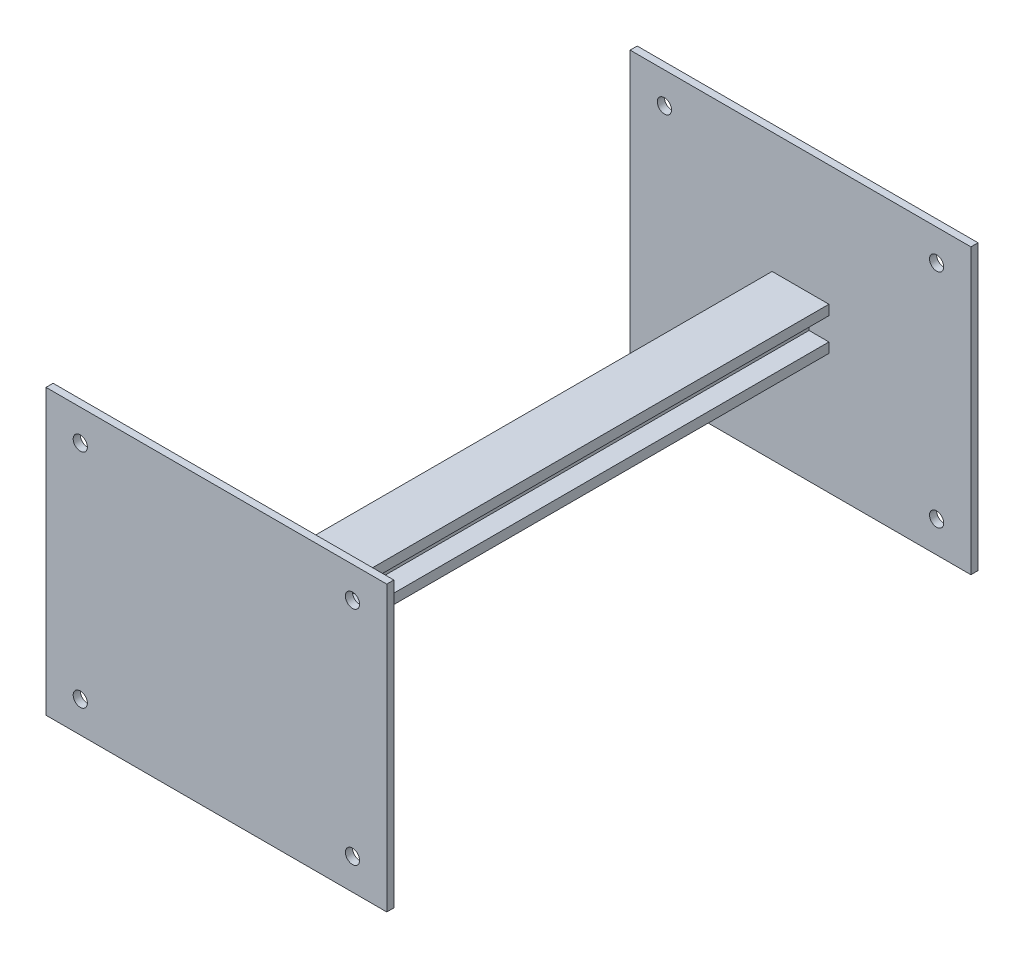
SolidWorks part; units mm, degrees
ref_plane "Front Plane" through (0, 0, 0) normal (0, 0, 1) x (1, 0, 0)
ref_plane "Top Plane" through (0, 0, 0) normal (0, 1, 0) x (1, 0, 0)
ref_plane "Right Plane" through (0, 0, 0) normal (1, 0, 0) x (0, 0, -1)
sketch "Sketch1" plane through (0, 0, 0) normal (0, 0, 1) x (1, 0, 0)
  line L0 (-7.62, 10.16) -> (-25.4, 10.16)
  line L1 (25.4, 10.16) -> (25.4, 19.05)
  line L2 (7.62, 10.16) -> (25.4, 10.16)
  line L3 (-25.4, -19.05) -> (25.4, -19.05)
  line L4 (-25.4, 10.16) -> (-25.4, 19.05)
  line L5 (-25.4, -10.16) -> (-25.4, -19.05)
  line L6 (-7.62, 0) -> (7.62, 0) construction
  line L7 (7.62, 10.16) -> (7.62, -10.16)
  line L8 (7.62, -10.16) -> (25.4, -10.16)
  line L9 (25.4, -10.16) -> (25.4, -19.05)
  line L10 (-25.4, 19.05) -> (25.4, 19.05)
  line L14 (-7.62, -10.16) -> (-25.4, -10.16)
  line L15 (-7.62, 10.16) -> (-7.62, -10.16)
  point P0 (0, 0)
  dimension "D1" = 38.1
  dimension "D2" = 20.32
  dimension "D3" = 17.78
  dimension "D4" = 50.8
extrude "Boss-Extrude1" add sketch "Sketch1" along normal blind 516.128
sketch "Sketch2" plane through (0, 0, 516.128) normal (0, 0, 1) x (1, 0, 0)
  line L0 (0, 32.6219) -> (0, 0) construction
  line L1 (-152.4, 127) -> (152.4, 127)
  line L2 (-152.4, 127) -> (-152.4, -127)
  line L3 (-152.4, -127) -> (152.4, -127)
  line L4 (152.4, 127) -> (152.4, -127)
  line L5 (-152.4, 127) -> (152.4, -127) construction
  line L6 (-152.4, -127) -> (152.4, 127) construction
  line L7 (0, 0) -> (29.6384, 0) construction
  point P0 (0, 0)
  dimension "D1" = 254
  dimension "D2" = 304.8
extrude "Boss-Extrude3" add sketch "Sketch2" along normal blind 6.35 separate body
sketch "Sketch3" plane through (0, 0, 0) normal (0, 0, -1) x (-1, 0, 0)
  line L0 (152.4, 127) -> (152.4, -127) construction
  line L1 (-152.4, 127) -> (152.4, 127)
  line L2 (-152.4, 127) -> (-152.4, -127)
  line L3 (-152.4, -127) -> (152.4, -127)
  line L4 (152.4, 127) -> (152.4, -127)
  line L5 (-152.4, 127) -> (152.4, -127) construction
  line L6 (-152.4, -127) -> (152.4, 127) construction
  point P0 (0, 0)
extrude "Boss-Extrude4" add sketch "Sketch3" along normal blind 6.35 separate body
sketch "Sketch4" plane through (0, 0, 522.478) normal (0, 0, 1) x (1, 0, 0)
  line L0 (0, 28.2424) -> (0, 0) construction
  line L1 (0, 0) -> (29.8059, 0) construction
  circle A0 centre (121.7327, 99.1914) radius 6.35
  circle A1 centre (121.7327, -99.1914) radius 6.35
  circle A2 centre (-121.7327, -99.1914) radius 6.35
  circle A3 centre (-121.7327, 99.1914) radius 6.35
  dimension "D1" = 12.7
extrude "Cut-Extrude1" cut sketch "Sketch4" against normal through all
